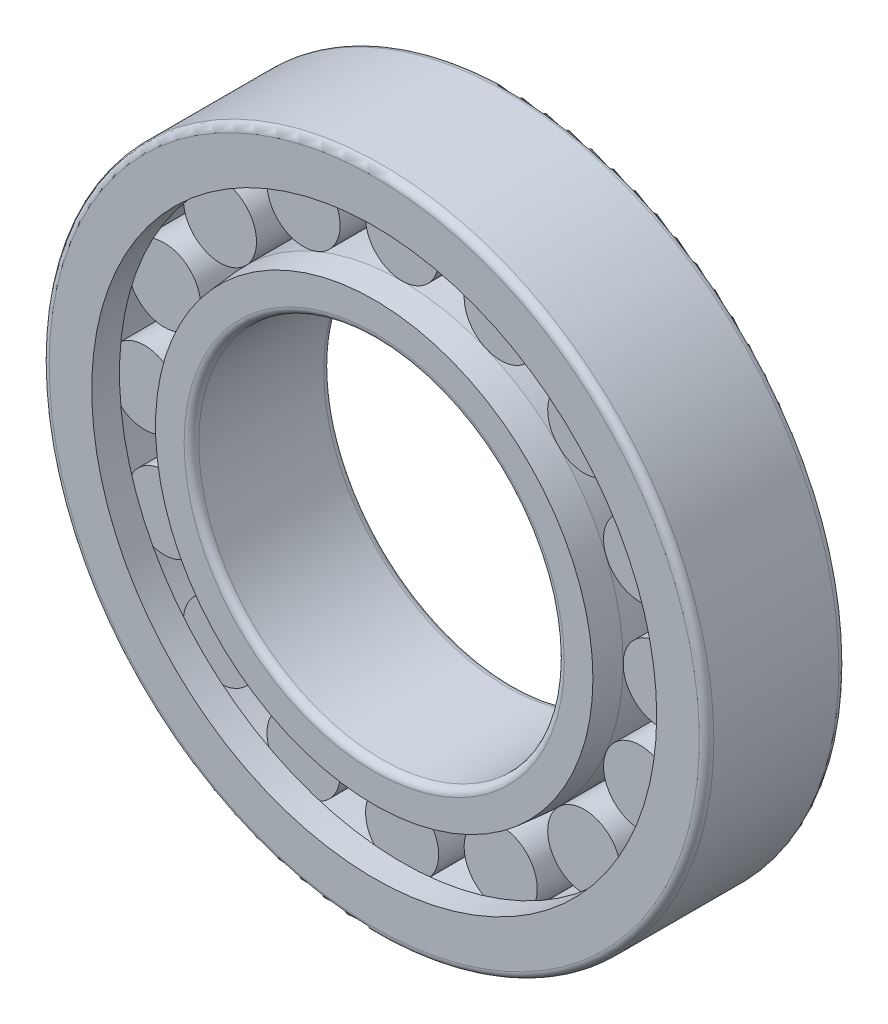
SolidWorks part; units mm, degrees
ref_plane "Front Plane" through (0, 0, 0) normal (0, 0, 1) x (1, 0, 0)
ref_plane "Top Plane" through (0, 0, 0) normal (0, 1, 0) x (1, 0, 0)
ref_plane "Right Plane" through (0, 0, 0) normal (1, 0, 0) x (0, 0, -1)
sketch "BaseSke" plane through (0, 0, 0) normal (1, 0, 0) x (0, 0, -1)
  line L0 (-47.2296, 0) -> (24.6132, 0) construction
  line L1 (-47.2296, 38.75) -> (24.6132, 38.75) construction
  line L2 (0, 129.5214) -> (0, -86.3012) construction
  line L3 (-6.3, 38.75) -> (-6.3, 44.25) construction
  line L4 (-10.5, 50) -> (10.5, 50) construction
  line L5 (-10.5, 27.5) -> (10.5, 27.5) construction
  line L6 (-6.3, 33.25) -> (6.3, 33.25)
  line L7 (-6.3, 33.25) -> (-6.3, 38.75)
  line L8 (-6.3, 38.75) -> (6.3, 38.75)
  line L9 (6.3, 33.25) -> (6.3, 38.75)
  line L10 (-6.3, 44.25) -> (6.3, 44.25) construction
  line L11 (6.3, 44.25) -> (6.3, 38.75) construction
  dimension "D2" = 12.6
  dimension "Bearing_Thickness" = 21
  dimension "Bearing_Outside_Diameter" = 100
  dimension "Bearing_Inside_Diameter" = 55
  dimension "Diameter_Fw" = 66.5
  dimension "Diameter_Ew" = 88.5
revolve "Roller" add sketch "BaseSke" angle 360 about L8
sketch "OuterRaceSke" plane through (0, 0, 0) normal (1, 0, 0) x (0, 0, -1)
  line L0 (0, 0) -> (0, 87.5396) construction
  line L1 (-10.5, 50) -> (10.5, 50)
  line L2 (-10.5, 50) -> (-10.5, 42.5)
  line L3 (-10.5, 42.5) -> (-6.325, 42.5)
  line L4 (10.5, 50) -> (10.5, 42.5)
  line L5 (-50.3916, 0) -> (55.2197, 0) construction
  line L6 (-6.3, 44.25) -> (6.3, 44.25) construction
  line L7 (6.325, 42.5) -> (10.5, 42.5)
  line L9 (-6.325, 42.5) -> (-6.325, 44.23)
  line L10 (-6.325, 44.23) -> (6.325, 44.23)
  line L11 (6.325, 42.5) -> (6.325, 44.23)
  dimension "D1" = 12.65
  dimension "D2" = 85
  dimension "D3" = 0.02
revolve "OuterRace" add sketch "OuterRaceSke" angle 360 about L5
sketch "InnerRaceSke" plane through (0, 0, 0) normal (1, 0, 0) x (0, 0, -1)
  line L0 (-70.8626, 0) -> (113.5527, 0) construction
  line L1 (0, 58.441) -> (0, -70.8113) construction
  line L2 (-10.5, 27.5) -> (10.5, 27.5)
  line L3 (-10.5, 27.5) -> (-10.5, 35)
  line L4 (-6.325, 35) -> (-6.325, 33.27)
  line L5 (-6.325, 35) -> (-10.5, 35)
  line L6 (0, 129.5214) -> (0, -86.3012) construction
  line L7 (-6.325, 33.27) -> (6.325, 33.27)
  line L9 (10.5, 27.5) -> (10.5, 35)
  line L10 (6.325, 35) -> (10.5, 35)
  line L11 (6.325, 33.27) -> (6.325, 35)
  line L13 (-6.3, 33.25) -> (6.3, 33.25) construction
  point P17 (0, 27.5)
  dimension "D2" = 0.02
  dimension "D1" = 12.65
  dimension "D3" = 70
revolve "InnerRace" add sketch "InnerRaceSke" angle 360 about L0
fillet "Fillet1" radius 1.1 4 edges at (27.5, 0, 10.5) (50, 0, -10.5) (50, 0, 10.5) (27.5, 0, -10.5)
sketch "CutGrooveSke" plane through (0, 0, 0) normal (1, 0, 0) x (0, 0, -1)
  line L0 (-51.8407, 0) -> (83.8302, 0) construction
  line L1 (-5.25, -69) -> (-6.3, -69)
  line L2 (-5.25, -69) -> (-5.25, -49)
  line L3 (-5.25, -49) -> (-6.3, -49)
  line L4 (-6.3, -69) -> (-6.3, -49)
  dimension "D1" = 49
  dimension "D2" = 5.25
  dimension "D3" = 1.05
  dimension "D4" = 20
revolve "CutGroove" [suppressed] cut sketch "CutGrooveSke" angle 360 about L0
sketch "TaperSke" plane through (0, 0, 0) normal (1, 0, 0) x (0, 0, -1)
  line L0 (-10.5, 27.5) -> (10.5, 27.5)
  line L1 (10.5, 27.5) -> (10.5, 29.25)
  line L2 (10.5, 29.25) -> (-10.5, 27.5)
  line L7 (-41.2502, 0) -> (40.8606, 0) construction
  dimension "Taper" = 1.75
revolve "Taper" [suppressed] cut sketch "TaperSke" angle 360 about L7
fillet "Fillet2" [suppressed] radius 1.1
sketch "NFSke" plane through (0, 0, 0) normal (1, 0, 0) x (0, 0, -1)
  line L0 (-54.6114, 0) -> (63.7655, 0) construction
  line L1 (10.5, 44.5953) -> (6.325, 44.23)
  line L2 (6.325, 44.23) -> (6.325, 42.5)
  line L3 (6.325, 42.5) -> (10.5, 42.5)
  line L4 (10.5, 42.5) -> (10.5, 44.5953)
  dimension "D1" = 5
revolve "NF" [suppressed] cut sketch "NFSke" angle 360 about L0
mirror "N" [suppressed] about plane through (0, 0, 0) normal (0, 0, 1)
sketch "NJSke" plane through (0, 0, 0) normal (1, 0, 0) x (0, 0, -1)
  line L0 (-35.6078, 0) -> (44.429, 0) construction
  line L1 (10.5, 35) -> (6.325, 35)
  line L2 (6.325, 35) -> (6.325, 33.27)
  line L3 (6.325, 33.27) -> (10.5, 32.9047)
  line L4 (10.5, 32.9047) -> (10.5, 35)
  dimension "D1" = 5
revolve "NJ" cut sketch "NJSke" angle 360 about L0
mirror "NU" about plane through (0, 0, 0) normal (0, 0, 1) of "NJ"
pattern_circular "CirPatternBall" count 16 over 360 about axis through (0, 0, 0) along (0, 0, 1) of "Roller"
sketch "SimplifiedSke" plane through (0, 0, 0) normal (1, 0, 0) x (0, 0, -1)
  line L0 (37.5911, 0) -> (-37.5911, 0) construction
  line L1 (-13.1351, 38.75) -> (13.151, 38.75) construction
  line L2 (-6.3, 44.25) -> (6.3, 44.25)
  line L3 (-6.3, 44.25) -> (-6.3, 33.25)
  line L4 (-6.3, 33.25) -> (6.3, 33.25)
  line L5 (6.3, 44.25) -> (6.3, 33.25)
  line L6 (-47.2296, 38.75) -> (24.6132, 38.75) construction
revolve "Simplified" [suppressed] add sketch "SimplifiedSke" angle 360 about L0
equation "\"D2@BaseSke\" = \"Bearing_Thickness@BaseSke\"*0.6"
equation "\"D1@OuterRaceSke\" = \"Bearing_Thickness@BaseSke\"*0.6+0.05"
equation "\"D2@OuterRaceSke\" =\"Bearing_Outside_Diameter@BaseSke\" -  ( \"Bearing_Outside_Diameter@BaseSke\" - \"Bearing_Inside_Diameter@BaseSke\"  )/ 3 "
equation "\"D1@InnerRaceSke\" = \"Bearing_Thickness@BaseSke\"*0.6+0.05"
equation "\"D3@InnerRaceSke\" = \"Bearing_Inside_Diameter@BaseSke\" +  ( \"Bearing_Outside_Diameter@BaseSke\" - \"Bearing_Inside_Diameter@BaseSke\" ) / 3 "
equation "\"D1@CirPatternBall\" =  int(  ( \"Bearing_Outside_Diameter@BaseSke\" + \"Bearing_Inside_Diameter@BaseSke\" )  / 2 *  pi  /  ( \"Bearing_Outside_Diameter@BaseSke\" - \"Bearing_Inside_Diameter@BaseSke\" ) * 3 ) "
equation "\"D1@CutGrooveSke\" = \"Bearing_Outside_Diameter@BaseSke\" * 0.49"
equation "\"D2@CutGrooveSke\" = \"Bearing_Thickness@BaseSke\" *0.25"
equation "\"D3@CutGrooveSke\" = \"Bearing_Thickness@BaseSke\"/20"
equation "\"Taper@TaperSke\" = \"Bearing_Thickness@BaseSke\"/12"
equation "\"D1@Fillet2\" = \"Fillet_radius@Fillet1\""
